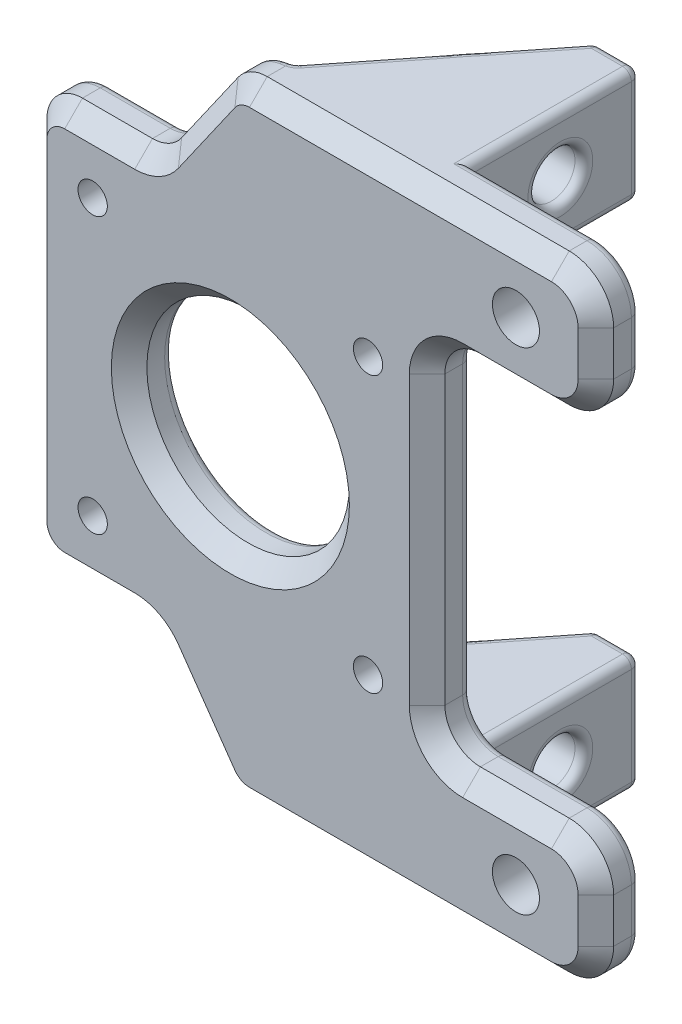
SolidWorks part; units mm, degrees
ref_plane "Front Plane" through (0, 0, 0) normal (0, 0, 1) x (1, 0, 0)
ref_plane "Top Plane" through (0, 0, 0) normal (0, 1, 0) x (1, 0, 0)
ref_plane "Right Plane" through (0, 0, 0) normal (1, 0, 0) x (0, 0, -1)
sketch "Sketch2" plane through (0, 0, 0) normal (0, 0, 1) x (1, 0, 0)
  line L1 (-21.15, -21.15) -> (21.15, -21.15) construction
  line L2 (-21.15, -21.15) -> (-21.15, 21.15) construction
  line L3 (-21.15, 21.15) -> (21.15, 21.15) construction
  line L4 (21.15, -21.15) -> (21.15, 21.15) construction
  line L5 (-21.15, -21.15) -> (21.15, 21.15) construction
  line L6 (-21.15, 21.15) -> (21.15, -21.15) construction
  line L7 (-15.5, -15.5) -> (15.5, -15.5) construction
  line L8 (-15.5, -15.5) -> (-15.5, 15.5) construction
  line L9 (-15.5, 15.5) -> (15.5, 15.5) construction
  line L10 (15.5, -15.5) -> (15.5, 15.5) construction
  line L11 (-15.5, -15.5) -> (15.5, 15.5) construction
  line L12 (-15.5, 15.5) -> (15.5, -15.5) construction
  line L13 (2.15, -35.15) -> (36.15, -35.15)
  line L14 (-22.65, -18.65) -> (-22.65, 18.65)
  line L15 (2.15, 35.15) -> (36.15, 35.15)
  line L16 (22.15, -16.15) -> (22.15, 16.15)
  line L19 (41.15, 30.15) -> (41.15, 25.15)
  line L20 (36.15, 20.15) -> (26.15, 20.15)
  line L21 (-22.65, 0) -> (22.15, 0) construction
  line L22 (36.15, -20.15) -> (26.15, -20.15)
  line L23 (41.15, -30.15) -> (41.15, -25.15)
  line L25 (41.15, 27.65) -> (32.15, 27.65) construction
  line L26 (41.15, -27.65) -> (32.15, -27.65) construction
  line L27 (-18.65, 22.65) -> (-10.7671, 22.65)
  line L28 (-7.4905, 24.3557) -> (-1.1266, 33.4443)
  line L29 (-18.65, -22.65) -> (-10.7671, -22.65)
  line L30 (-7.4905, -24.3557) -> (-1.1266, -33.4443)
  circle A0 centre (0, 0) radius 11 construction
  circle A1 centre (15.5, 15.5) radius 1.5 construction
  circle A2 centre (-15.5, 15.5) radius 1.5 construction
  circle A3 centre (-15.5, -15.5) radius 1.5 construction
  circle A4 centre (15.5, -15.5) radius 1.5 construction
  arc A5 (2.15, -35.15) -> (-1.1266, -33.4443) centre (2.15, -31.15) cw
  arc A6 (2.15, 35.15) -> (-1.1266, 33.4443) centre (2.15, 31.15) ccw
  arc A7 (36.15, 20.15) -> (41.15, 25.15) centre (36.15, 25.15) ccw
  arc A8 (41.15, 30.15) -> (36.15, 35.15) centre (36.15, 30.15) ccw
  arc A9 (36.15, -20.15) -> (41.15, -25.15) centre (36.15, -25.15) cw
  arc A10 (41.15, -30.15) -> (36.15, -35.15) centre (36.15, -30.15) cw
  arc A11 (26.15, -20.15) -> (22.15, -16.15) centre (26.15, -16.15) cw
  arc A12 (22.15, 16.15) -> (26.15, 20.15) centre (26.15, 16.15) cw
  circle A13 centre (15.5, 15.5) radius 1.65
  circle A14 centre (15.5, -15.5) radius 1.65
  circle A15 centre (-15.5, 15.5) radius 1.65
  circle A16 centre (-15.5, -15.5) radius 1.65
  circle A17 centre (0, 0) radius 11.4
  circle A18 centre (32.15, 27.65) radius 2.65
  circle A19 centre (32.15, -27.65) radius 2.65
  arc A20 (-7.4905, -24.3557) -> (-10.7671, -22.65) centre (-10.7671, -26.65) ccw
  arc A21 (-7.4905, 24.3557) -> (-10.7671, 22.65) centre (-10.7671, 26.65) cw
  arc A22 (-22.65, -18.65) -> (-18.65, -22.65) centre (-18.65, -18.65) ccw
  arc A23 (-18.65, 22.65) -> (-22.65, 18.65) centre (-18.65, 18.65) ccw
  point P0 (0, 0)
  point P6 (0, 0)
  point P21 (0.0677, -35.15)
  point P25 (0.0677, 35.15)
  point P45 (22.15, -20.15)
  point P48 (22.15, 20.15)
  dimension "D4" = 22.8
  dimension "D5" = 31
  dimension "D11" = 1.5
  dimension "D7" = 3.3
  dimension "D13" = 4
  dimension "D14" = 15
  dimension "D15" = 20
  dimension "D16" = 5.3
  dimension "D17" = 10
  dimension "D3" = 22
  dimension "D6" = 3
  dimension "D21" = 5
  dimension "D22" = 4
  dimension "D1" = 42.3
  dimension "D2" = 42.3
  dimension "D8" = 1
  dimension "D9" = 19
  dimension "D10" = 1.5
  dimension "D12" = 1.5
  dimension "D18" = 125
  dimension "D19" = 14
  dimension "D20" = 125
extrude "Boss-Extrude1" add sketch "Sketch2" along normal blind 5
sketch "Sketch3" plane through (0, 35.15, 0) normal (0, 1, 0) x (1, 0, 0)
  line L0 (22.15, 0) -> (22.15, 19)
  line L1 (22.15, 19) -> (17.15, 19)
  line L2 (17.15, 19) -> (2.15, 0)
  line L3 (36.15, 0) -> (2.15, 0) construction
  line L4 (2.15, 0) -> (22.15, 0)
  line L5 (2.15, -5) -> (2.15, 0) construction
  line L6 (36.15, 0) -> (2.15, 0) construction
  dimension "D2" = 5
  dimension "D3" = 19
extrude "Boss-Extrude2" add sketch "Sketch3" against normal blind 13
mirror "Mirror1" about plane through (0, 0, 0) normal (0, 1, 0) of "Boss-Extrude2"
sketch "Sketch5" plane through (22.15, 0, 0) normal (1, 0, 0) x (0, 0, -1)
  line L0 (0, 30.15) -> (0, 35.15) construction
  line L1 (19, 28.65) -> (0, 28.65) construction
  line L2 (19, 22.15) -> (19, 35.15) construction
  line L3 (0, 0) -> (-5, 0) construction
  line L4 (-5, -16.15) -> (-5, 16.15) construction
  circle A0 centre (10, 28.65) radius 2.65
  circle A1 centre (10, -28.65) radius 2.65
  dimension "D1" = 5.3
  dimension "D2" = 10
extrude "Cut-Extrude1" cut sketch "Sketch5" against normal blind 5
sketch "Sketch6" plane through (17.15, 0, 0) normal (1, 0, 0) x (0, 0, -1)
  circle A0 centre (10, 28.65) radius 4.75
  circle A1 centre (10, -28.65) radius 4.75
  dimension "D1" = 9.5
extrude "Cut-Extrude2" cut sketch "Sketch6" against normal up to next
chamfer "Chamfer1" distance 2 angle 45 24 edges at (-8.9201, -23.102, 5) (-4.3086, -28.9, 5) (-14.7086, -22.65, 5) (0.303, -34.698, 5) (-21.4784, -21.4784, 5) (19.15, -35.15, 5) (-22.65, 0, 5) (39.6855, -33.6855, 5) (-21.4784, 21.4784, 5) (41.15, -27.65, 5) (-14.7086, 22.65, 5) (39.6855, -21.6145, 5) (-8.9201, 23.102, 5) (31.15, -20.15, 5) (-4.3086, 28.9, 5) (23.3216, -18.9784, 5) (0.303, 34.698, 5) (22.15, 0, 5) (19.15, 35.15, 5) (23.3216, 18.9784, 5) (39.6855, 33.6855, 5) (31.15, 20.15, 5) (41.15, 27.65, 5) (39.6855, 21.6145, 5)
chamfer "Chamfer2" distance 2 angle 45 1 edges at (11.4, 0, 5)
fillet "Fillet1" radius 1 11 edges at (22.15, 31.3, -10) (22.15, -31.3, -10) (34.8, -27.65, 0) (34.8, 27.65, 0) (11.4, 0, 0) (17.15, 15.5, 0) (-13.85, 15.5, 0) (-13.85, -15.5, 0) (17.15, -15.5, 0) (13.7947, 28.65, -14.75) (13.7947, -28.65, -14.75)
fillet "Fillet2" radius 1 42 edges at (2.15, -28.65, 0) (2.15, 28.65, 0) (0.303, 34.698, 0) (-4.3086, 28.9, 0) (-8.9201, 23.102, 0) (-14.7086, 22.65, 0) (-21.4784, 21.4784, 0) (-22.65, 0, 0) (-21.4784, -21.4784, 0) (-14.7086, -22.65, 0) (-8.9201, -23.102, 0) (-4.3086, -28.9, 0) (29.15, -35.15, 0) (39.6855, -33.6855, 0) (41.15, -27.65, 0) (39.6855, -21.6145, 0) (31.15, -20.15, 0) (23.3216, -18.9784, 0) (22.15, 0, 0) (23.3216, 18.9784, 0) (31.15, 20.15, 0) (39.6855, 21.6145, 0) (41.15, 27.65, 0) (29.15, 35.15, 0) (17.15, 28.65, -19) (19.65, 22.15, -19) (22.15, 28.65, -19) (19.65, 35.15, -19) (22.15, -28.65, -19) (19.65, -22.15, -19) (17.15, -28.65, -19) (19.65, -35.15, -19) (12.15, -22.15, 0) (12.15, 22.15, 0) (0.303, -34.698, 0) (39.6855, 33.6855, 0) (22.15, 35.15, -9.5) (22.15, -35.15, -9.5) (9.65, -35.15, -9.5) (9.65, -22.15, -9.5) (9.65, 35.15, -9.5) (9.65, 22.15, -9.5)
fillet "Fillet3" radius 1 6 edges at (22.15, -21.8571, -0.2929) (21.8571, -22.4429, -18.7071) (22.15, 21.8571, -0.2929) (21.8571, 22.4429, -18.7071) (22.15, -22.15, -9.5) (22.15, 22.15, -9.5)
